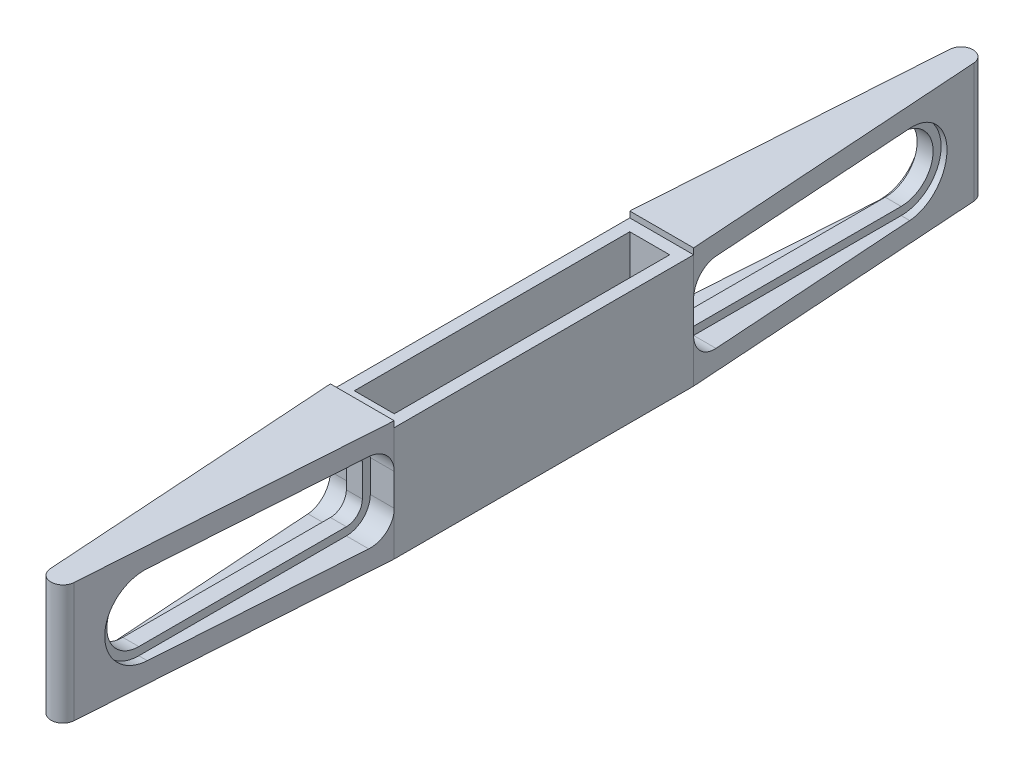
SolidWorks part; units mm, degrees
ref_plane "Front" through (0, 0, 0) normal (0, 0, 1) x (1, 0, 0)
ref_plane "Top" through (0, 0, 0) normal (0, 1, 0) x (1, 0, 0)
ref_plane "Right" through (0, 0, 0) normal (1, 0, 0) x (0, 0, -1)
sketch "Sketch1" plane through (0, 0, 0) normal (0, 1, 0) x (1, 0, 0)
  line L0 (0, 0) -> (55.1982, 0) construction
  line L1 (0, 0) -> (0, 49.235) construction
  line L2 (8, 37.5) -> (2.9934, 112.6993)
  line L3 (-8, 37.5) -> (-2.9934, 112.6993)
  line L4 (8, 37.5) -> (8, -37.5)
  line L5 (-8, 37.5) -> (-8, -37.5)
  line L6 (-8, -37.5) -> (-2.9934, -112.6993)
  line L7 (8, -37.5) -> (2.9934, -112.6993)
  arc A0 (-2.9934, 112.6993) -> (2.9934, 112.6993) centre (0, 112.5) cw
  arc A1 (-2.9934, -112.6993) -> (2.9934, -112.6993) centre (0, -112.5) ccw
  point P15 (-8, 0)
  point P16 (8, 0)
  dimension "D2" = 3
  dimension "D1" = 225
  dimension "D3" = 75
  dimension "D4" = 16
extrude "Base-Extrude" add sketch "Sketch1" along normal blind 30
sketch "Sketch2" plane through (8, 0, 0) normal (1, 0, 0) x (0, 0, -1)
  line L0 (-37.5, 15) -> (-127.9941, 15) construction
  line L1 (-37.5, 30) -> (-37.5, 0) construction
  line L2 (-37.5, 5) -> (-95.5, 5)
  line L3 (-37.5, 25) -> (-95.5, 25)
  line L4 (-115.5, 30) -> (-115.5, 0) construction
  line L5 (-37.5, 25) -> (-37.5, 5)
  arc A0 (-95.5, 5) -> (-95.5, 25) centre (-95.5, 15) cw
  dimension "D1" = 10
  dimension "D2" = 20
extrude "Cut-Extrude1" cut sketch "Sketch2" against normal blind 6
fillet "Fillet1" radius 6 2 edges at (5, 25, 37.5) (5, 5, 37.5)
mirror "Mirror1" about plane through (0, 0, 0) normal (1, 0, 0) of "Fillet1", "Cut-Extrude1"
mirror "Mirror2" about plane through (0, 0, 0) normal (0, 0, 1) of "Mirror1", "Cut-Extrude1", "Fillet1"
sketch "Sketch5" plane through (0, 30, 0) normal (0, 1, 0) x (-1, 0, 0)
  line L0 (8, 37.5) -> (-8, 37.5)
  line L1 (8, 37.5) -> (8, -37.5)
  line L2 (-8, -37.5) -> (8, -37.5)
  line L3 (-8, -37.5) -> (-8, 37.5)
  line L4 (0, 0) -> (0, -42.9632) construction
  line L5 (8, -37.5) -> (8, 37.5) construction
  line L6 (-8, -37.5) -> (-8, 37.5) construction
extrude "Cut-Extrude3" cut sketch "Sketch5" against normal blind 1.5
sketch "Sketch6" plane through (0, 28.5, 0) normal (0, 1, 0) x (1, 0, 0)
  line L8 (-5, 34.5) -> (-5, -34.5)
  line L9 (-5, -34.5) -> (5, -34.5)
  line L10 (5, -34.5) -> (5, 34.5)
  line L11 (5, 34.5) -> (-5, 34.5)
  line L12 (-5, 34.5) -> (-5, -34.5)
  line L13 (-5, -34.5) -> (5, -34.5)
  line L14 (5, -34.5) -> (5, 34.5)
  line L15 (5, 34.5) -> (-5, 34.5)
  dimension "D1" = 3
extrude "Cut-Extrude4" cut sketch "Sketch6" against normal offset from surface (18.5 mm away) 10
sketch "Sketch7" plane through (2, 0, 0) normal (1, 0, 0) x (0, 0, -1)
  line L3 (0, 0) -> (0, 61.8139) construction
  line L4 (39.5, 11) -> (39.5, 19)
  line L5 (43.5, 23) -> (95.5, 23)
  line L6 (-95.5, 7) -> (-43.5, 7)
  line L7 (-39.5, 11) -> (-39.5, 19)
  line L8 (-43.5, 23) -> (-95.5, 23)
  line L9 (-95.5, 7) -> (-43.5, 7)
  line L10 (-39.5, 11) -> (-39.5, 19)
  line L11 (-43.5, 23) -> (-95.5, 23)
  line L12 (95.5, 7) -> (43.5, 7)
  arc A3 (43.5, 7) -> (39.5, 11) centre (43.5, 11) cw
  arc A4 (95.5, 23) -> (95.5, 7) centre (95.5, 15) cw
  arc A5 (39.5, 19) -> (43.5, 23) centre (43.5, 19) cw
  arc A6 (-43.5, 7) -> (-39.5, 11) centre (-43.5, 11) ccw
  arc A7 (-39.5, 19) -> (-43.5, 23) centre (-43.5, 19) ccw
  arc A8 (-95.5, 23) -> (-95.5, 7) centre (-95.5, 15) ccw
  arc A9 (-43.5, 7) -> (-39.5, 11) centre (-43.5, 11) ccw
  arc A10 (-39.5, 19) -> (-43.5, 23) centre (-43.5, 19) ccw
  arc A11 (-95.5, 23) -> (-95.5, 7) centre (-95.5, 15) ccw
  dimension "D1" = 2
extrude "Cut-Extrude5" cut sketch "Sketch7" against normal through all
